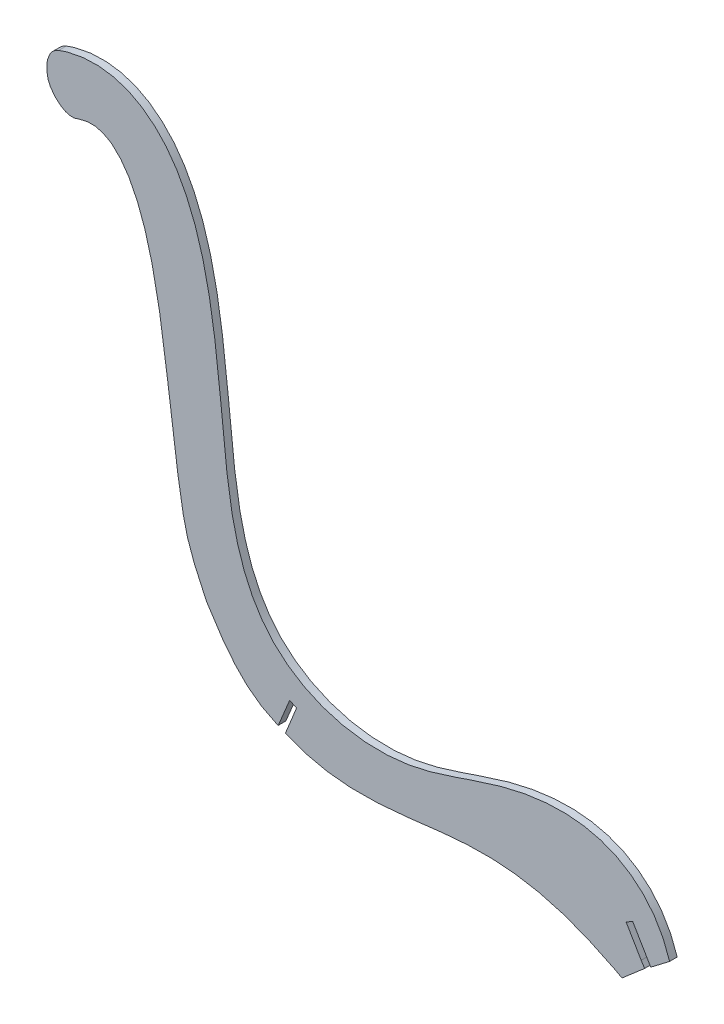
SolidWorks part; units mm, degrees
ref_plane "Front Plane" through (0, 0, 0) normal (0, 0, 1) x (1, 0, 0)
ref_plane "Top Plane" through (0, 0, 0) normal (0, 1, 0) x (1, 0, 0)
ref_plane "Right Plane" through (0, 0, 0) normal (1, 0, 0) x (0, 0, -1)
sketch "Sketch1" plane through (0, 0, 0) normal (0, 0, 1) x (1, 0, 0)
  line L0 (1077.2771, 51.021) -> (1117.6176, 81.8963)
  line L1 (125.4032, 254.4304) -> (103.3665, 299.1972) construction
  line L2 (1015.634, 0.1765) -> (1064.0697, 42.0308)
  line L3 (103.3665, 299.1972) -> (90.4749, 330.1662) construction
  line L4 (1077.2771, 51.021) -> (1038.5505, 116.6464)
  line L5 (90.4749, 330.1662) -> (83.5473, 350.5197) construction
  line L7 (83.5473, 350.5197) -> (79.7127, 365.4459) construction
  line L9 (79.7127, 365.4459) -> (77.0158, 379.1881) construction
  line L10 (1077.2771, 51.021) -> (1222.7228, 51.021) construction
  line L11 (294.7019, 93.6594) -> (294.7003, 93.6569)
  line L12 (77.0158, 379.1881) -> (74.3951, 394.3259) construction
  line L13 (74.3951, 394.3259) -> (71.429, 412.0203) construction
  line L14 (294.7019, 93.6594) -> (318.668, 152.4631)
  line L15 (71.429, 412.0203) -> (68.0671, 432.5088) construction
  line L16 (68.0671, 432.5088) -> (64.4251, 455.5484) construction
  line L17 (64.4251, 455.5484) -> (60.656, 480.7205) construction
  line L18 (60.656, 480.7205) -> (56.8837, 507.6008) construction
  line L19 (56.8837, 507.6008) -> (53.1778, 535.8316) construction
  line L20 (53.1778, 535.8316) -> (49.5522, 565.1353) construction
  line L21 (49.5522, 565.1353) -> (45.9729, 595.2982) construction
  line L22 (45.9729, 595.2982) -> (42.3761, 626.146) construction
  line L23 (42.3761, 626.146) -> (38.6675, 657.5165) construction
  line L24 (38.6675, 657.5165) -> (34.7422, 689.2424) construction
  line L25 (34.7422, 689.2424) -> (30.4873, 721.1363) construction
  line L26 (30.4873, 721.1363) -> (25.7858, 752.9825) construction
  line L27 (25.7858, 752.9825) -> (20.5214, 784.5337) construction
  line L28 (20.5214, 784.5337) -> (14.5813, 815.5103) construction
  line L29 (14.5813, 815.5103) -> (7.8595, 845.6026) construction
  line L30 (7.8595, 845.6026) -> (0.2595, 874.4746) construction
  line L31 (0.2595, 874.4746) -> (-8.3018, 901.7699) construction
  line L32 (-8.3018, 901.7699) -> (-17.891, 927.1182) construction
  line L33 (-17.891, 927.1182) -> (-28.5543, 950.143) construction
  line L34 (-28.5543, 950.143) -> (-40.3141, 970.4732) construction
  line L35 (-40.3141, 970.4732) -> (-53.1663, 987.7675) construction
  line L36 (-53.1663, 987.7675) -> (-67.0786, 1001.7613) construction
  line L37 (-67.0786, 1001.7613) -> (-81.9916, 1012.2705) construction
  line L38 (-81.9916, 1012.2705) -> (-97.827, 1018.8744) construction
  line L39 (-97.827, 1018.8744) -> (-114.4901, 1020.4319) construction
  line L40 (-114.4901, 1020.4319) -> (-131.8156, 1017.6658) construction
  line L41 (-131.8156, 1017.6658) -> (-149.6084, 1011.2836) construction
  line L42 (1117.6176, 81.8963) -> (1117.6203, 81.909)
  line L43 (318.668, 152.4631) -> (303.8509, 159.2561)
  line L44 (1015.634, 0.1765) -> (973.552, 23.3938) construction
  line L45 (973.552, 23.3938) -> (934.5529, 41.9431) construction
  line L46 (1038.5505, 116.6464) -> (1024.5126, 108.3623)
  line L47 (934.5529, 41.9431) -> (898.3281, 56.4354) construction
  line L48 (898.3281, 56.4354) -> (864.5759, 67.4365) construction
  line L49 (864.5759, 67.4365) -> (833.0224, 75.4589) construction
  line L50 (311.7947, 155.8028) -> (272.9241, 61.6343) construction
  line L52 (279.4301, 100.6398) -> (303.8509, 159.2561)
  line L53 (1056.7847, 53.6745) -> (1024.5126, 108.3623)
  line L54 (1056.7847, 53.6745) -> (1064.0697, 42.0308)
  line L84 (833.0224, 75.4589) -> (803.4194, 80.965) construction
  line L85 (803.4194, 80.965) -> (775.5429, 84.3714) construction
  line L86 (775.5429, 84.3714) -> (749.1912, 86.0518) construction
  line L87 (749.1912, 86.0518) -> (724.1834, 86.3404) construction
  line L88 (724.1834, 86.3404) -> (700.3578, 85.5354) construction
  line L89 (700.3578, 85.5354) -> (677.5704, 83.9011) construction
  line L90 (677.5704, 83.9011) -> (655.6936, 81.6719) construction
  line L91 (655.6936, 81.6719) -> (634.6148, 79.0516) construction
  line L92 (634.6148, 79.0516) -> (614.2355, 76.2214) construction
  line L93 (614.2355, 76.2214) -> (594.47, 73.3365) construction
  line L94 (594.47, 73.3365) -> (575.2454, 70.5308) construction
  line L95 (575.2454, 70.5308) -> (556.5002, 67.918) construction
  line L96 (556.5002, 67.918) -> (538.1848, 65.5929) construction
  line L97 (538.1848, 65.5929) -> (520.2615, 63.633) construction
  line L98 (520.2615, 63.633) -> (502.7048, 62.0992) construction
  line L99 (502.7048, 62.0992) -> (485.5024, 61.0368) construction
  line L100 (485.5024, 61.0368) -> (468.6559, 60.4759) construction
  line L101 (468.6559, 60.4759) -> (452.1815, 60.4323) construction
  line L102 (452.1815, 60.4323) -> (436.1099, 60.9079) construction
  line L103 (436.1099, 60.9079) -> (420.4848, 61.8926) construction
  line L104 (420.4848, 61.8926) -> (405.3577, 63.3662) construction
  line L105 (405.3577, 63.3662) -> (390.7829, 65.3014) construction
  line L106 (390.7829, 65.3014) -> (376.824, 67.6629) construction
  line L107 (376.824, 67.6629) -> (363.5912, 70.3985) construction
  line L108 (363.5912, 70.3985) -> (351.1978, 73.4511) construction
  line L109 (351.1978, 73.4511) -> (339.1675, 76.9372) construction
  line L110 (339.1675, 76.9372) -> (325.3993, 81.4924) construction
  line L111 (325.3993, 81.4924) -> (309.9341, 87.2814) construction
  line L112 (309.9341, 87.2814) -> (294.7003, 93.6569) construction
  spline S0 degree 3 poles (279.4301, 100.6398) (252.6127, 110.8499) (212.013, 137.0403) (164.1965, 193.7714) (139.1033, 231.3545) (125.4032, 254.4304) knots 0 0 0 0 0.388636 0.637165 1 1 1 1
  spline_without_curve S1
  spline S3 degree 3 poles (1117.6203, 81.909) (1112.7369, 98.1364) (1103.6546, 120.3628) (1088.7748, 144.9542) (1074.0699, 165.4039) (1047.6722, 193.7523) (1002.3041, 223.4807) (938.152, 244.01) (846.5359, 248.0097) (719.4496, 219.8626) (574.4472, 158.1064) (407.6552, 159.621) (289.0395, 220.2126) (222.5041, 306.0944) (179.1423, 419.9289) (164.0484, 561.4316) (148.9312, 715.6116) (129.0039, 854.1155) (91.9372, 978.5099) (30.9195, 1073.7304) (-64.4257, 1138.5586) (-147.6093, 1134.2854) (-190.6337, 1117.5977) knots 0 0 0 0 0.024734 0.034814 0.04188 0.061472 0.090996 0.119916 0.158765 0.223298 0.308194 0.387021 0.458603 0.493488 0.543545 0.634054 0.700066 0.769862 0.838072 0.887863 0.932132 1 1 1 1
  spline_without_curve S4
  spline S7 degree 3 poles (-149.6084, 1011.2836) (-169.9568, 1001.1277) (-208.5019, 1028.6975) (-220.827, 1078.4357) (-209.4289, 1110.8488) (-190.6337, 1117.5977) knots 0 0 0 0 0.429761 0.644947 1 1 1 1
extrude "Boss-Extrude1" add sketch "Sketch1" along normal blind 16.3
equation "\"material depth\"= 0.6417323"
equation "\"D1@Boss-Extrude1\"=\"material depth\""
equation "\"R1\"= 6.31"
equation "\"L1\"= 33.89"
equation "\"L2\"= 8.74"
equation "\"D5@Sketch1\"=\"L1\""
equation "\"D4@Sketch1\"=\"R1\""
equation "\"D6@Sketch1\"=\"L2\""
equation "\"material side depth\"= 2.5"
equation "\"D7@Sketch1\"=\"material side depth\""
equation "\"D8@Sketch1\"=\"material side depth\""
equation "\"D3@Sketch1\"=\"material depth\""
equation "\"L3\"= 29.17"
equation "\"D9@Sketch1\"=\"L3\""
equation "\"lower L1\"= 2.87"
equation "\"lowerL2\"=2"
equation "\"D11@Sketch1\"=\"lowerL2\""
equation "\"D16@Sketch1\"=\"material depth\""
equation "\"material side depth 2\"= 3.0"
equation "\"D2@Sketch1\"=\"material side depth 2\""
